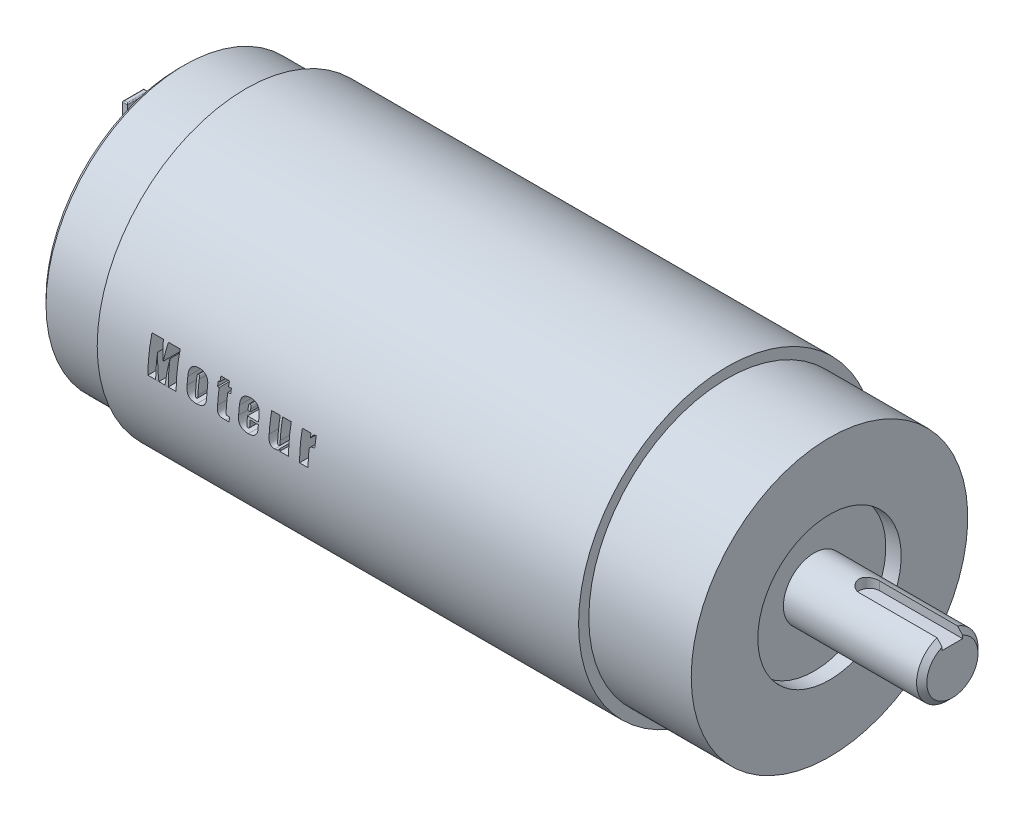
SolidWorks part; units mm, degrees
ref_plane "Plane1" through (0, 0, 0) normal (0, 0, 1) x (1, 0, 0)
ref_plane "Plane2" through (0, 0, 0) normal (0, 1, 0) x (1, 0, 0)
ref_plane "Plane3" through (0, 0, 0) normal (1, 0, 0) x (0, 0, -1)
sketch "Esquisse1" plane through (0, 0, 0) normal (0, 0, 1) x (1, 0, 0)
  line L0 (12, 0) -> (12, 3)
  line L1 (12, 3) -> (-1.5, 3)
  line L2 (-1.5, 3) -> (-1.5, 7)
  line L3 (-1.5, 7) -> (0, 7)
  line L4 (0, 7) -> (0, 13.5)
  line L5 (0, 0) -> (0, -16) construction
  line L6 (0, 13.5) -> (-10, 13.5)
  line L7 (-10, 13.5) -> (-10, 14.5)
  line L8 (-10, 14.5) -> (-57, 14.5)
  line L9 (-57, 14.5) -> (-57, 13.5)
  line L10 (-57, 13.5) -> (-63, 13.5)
  line L11 (-63, 13.5) -> (-63.5, 13)
  line L12 (-63.5, 13) -> (-63.5, 8)
  line L13 (-64.5, 7) -> (-64.5, 0)
  line L14 (-64.5, 0) -> (12, 0)
  line L15 (-76.5, 0) -> (25, 0) construction
  arc A0 (-63.5, 8) -> (-64.5, 7) centre (-63.5, 7) ccw
revolve "Base-Révolution" add sketch "Esquisse1" angle 360 about L15
chamfer "Chanfrein3" distance 0.5 angle 45
sketch "Esquisse2" plane through (12, 0, 0) normal (1, 0, 0) x (0, 0, -1)
  line L0 (-1, 3.5) -> (1, 3.5)
  line L1 (-1, 3.5) -> (-1, 2)
  line L2 (1, 2) -> (-1, 2)
  line L3 (1, 2) -> (1, 3.5)
extrude "Enlèv. mat.-Extru.1" cut sketch "Esquisse2" against normal blind 8.1
sketch "Esquisse3" plane through (0, 2, 0) normal (0, 1, 0) x (-1, 0, 0)
  circle A0 centre (-3.9, 0) radius 1
extrude "Enlèv. mat.-Extru.2" cut sketch "Esquisse3" along normal blind 2.1
ref_plane "Plan4" through (0, 0, 14.5) normal (0, 0, 1) x (1, 0, 0)
sketch "Esquisse5" plane through (0, 0, 14.5) normal (0, 0, 1) x (1, 0, 0)
  text T0 "M o t e u r" font "Impact" height 3.5
  point P1 (0, 0)
extrude "Enlèv. mat.-Extru.3" cut sketch "Esquisse5" against normal blind 2.1
sketch "Esquisse6" plane through (0, 0, 0) normal (0, 0, 1) x (1, 0, 0)
  line L0 (-62, 5) -> (-66, 5)
  line L1 (-67.5, 6.5) -> (-67.5, 8.5)
  line L2 (-67.5, 8.5) -> (-68, 8.5)
  line L3 (-68, 8.5) -> (-68, 6.5)
  line L4 (-66, 4.5) -> (-62, 4.5)
  line L5 (-62, 4.5) -> (-62, 5)
  line L6 (-83.5, 0) -> (-55.5, 0) construction
  line L7 (-76.5, 0) -> (25, 0) construction
  line L8 (-62, -4.5) -> (-62, -5)
  line L9 (-66, -4.5) -> (-62, -4.5)
  line L10 (-68, -8.5) -> (-68, -6.5)
  line L11 (-67.5, -8.5) -> (-68, -8.5)
  line L12 (-67.5, -6.5) -> (-67.5, -8.5)
  line L13 (-62, -5) -> (-66, -5)
  arc A0 (-66, 5) -> (-67.5, 6.5) centre (-66, 6.5) cw
  arc A1 (-68, 6.5) -> (-66, 4.5) centre (-66, 6.5) ccw
  arc A2 (-68, -6.5) -> (-66, -4.5) centre (-66, -6.5) cw
  arc A3 (-66, -5) -> (-67.5, -6.5) centre (-66, -6.5) ccw
extrude "Boss.-Extru.2" add sketch "Esquisse6" along normal mid plane 2.1
fillet "Congé1" radius 0.1
